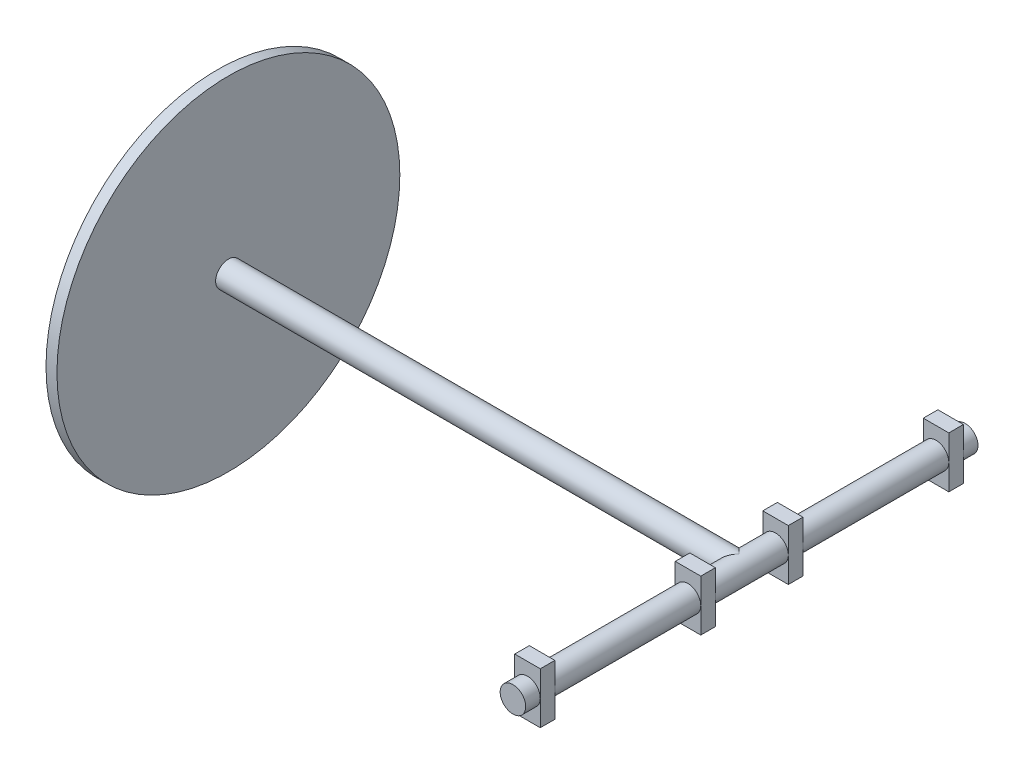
SolidWorks part; units mm, degrees
ref_plane "Face" through (0, 0, 0) normal (0, 0, 1) x (1, 0, 0)
ref_plane "Dessus" through (0, 0, 0) normal (0, 1, 0) x (1, 0, 0)
ref_plane "Droite" through (0, 0, 0) normal (1, 0, 0) x (0, 0, -1)
sketch "Esquisse1" plane through (0, 0, 0) normal (0, 0, 1) x (1, 0, 0)
  circle A0 centre (0, 0) radius 3.5
  dimension "D1" = 7
extrude "Extrusion1" add sketch "Esquisse1" along normal blind 10
sketch "Esquisse2" plane through (0, 0, 10) normal (0, 0, 1) x (1, 0, 0)
  line L1 (-3.5, 7) -> (3.5, 7)
  line L2 (-3.5, 7) -> (-3.5, -7)
  line L3 (-3.5, -7) -> (3.5, -7)
  line L4 (3.5, 7) -> (3.5, -7)
  circle A0 centre (0, 0) radius 3.5 construction
  dimension "D1" = 7
  dimension "D2" = 7
extrude "Extrusion2" add sketch "Esquisse2" along normal blind 4
sketch "Esquisse3" plane through (0, 0, 14) normal (0, 0, 1) x (1, 0, 0)
  arc A0 (-3.5, 0) -> (3.5, 0) centre (0, 0) ccw construction
  arc A1 (-3.5, 0) -> (3.5, 0) centre (0, 0) ccw
  arc A2 (3.5, 0) -> (-3.5, 0) centre (0, 0) ccw construction
  arc A3 (3.5, 0) -> (-3.5, 0) centre (0, 0) ccw
extrude "Extrusion3" add sketch "Esquisse3" along normal blind 40
sketch "Esquisse4" plane through (0, 0, 54) normal (0, 0, 1) x (1, 0, 0)
  line L3 (3.5, 0) -> (3.5, 7)
  line L4 (3.5, 7) -> (-3.5, 7)
  line L5 (-3.5, 7) -> (-3.5, 0)
  line L6 (3.5, 0) -> (3.5, 7)
  line L7 (3.5, 7) -> (-3.5, 7)
  line L8 (-3.5, 7) -> (-3.5, 0)
  line L9 (-3.5, 0) -> (-3.5, -7)
  line L10 (-3.5, -7) -> (3.5, -7)
  line L11 (3.5, -7) -> (3.5, 0)
  line L12 (-3.5, 0) -> (-3.5, -7)
  line L13 (-3.5, -7) -> (3.5, -7)
  line L14 (3.5, -7) -> (3.5, 0)
  arc A1 (3.5, 0) -> (-3.5, 0) centre (0, 0) ccw
  arc A3 (-3.5, 0) -> (3.5, 0) centre (0, 0) ccw
  dimension "D1" = 0
  dimension "D2" = 0
extrude "Extrusion4" add sketch "Esquisse4" along normal blind 4
sketch "Esquisse5" plane through (0, 0, 58) normal (0, 0, 1) x (1, 0, 0)
  arc A0 (-3.5, 0) -> (3.5, 0) centre (0, 0) ccw construction
  arc A1 (-3.5, 0) -> (3.5, 0) centre (0, 0) ccw
  arc A2 (3.5, 0) -> (-3.5, 0) centre (0, 0) ccw construction
  arc A3 (3.5, 0) -> (-3.5, 0) centre (0, 0) ccw
extrude "Extrusion5" add sketch "Esquisse5" along normal blind 4
mirror "Symétrie1" about plane through (0, 0, 0) normal (0, 0, 1) of "Extrusion1", "Extrusion2", "Extrusion3", "Extrusion4", "Extrusion5"
sketch "Esquisse6" plane through (0, 0, 0) normal (1, 0, 0) x (0, 0, -1)
  line L0 (10, 3.5) -> (-10, 3.5) construction
  circle A0 centre (0, 0) radius 3.5
extrude "Extrusion6" add sketch "Esquisse6" against normal blind 140
sketch "Esquisse7" plane through (-140, 0, 0) normal (-1, 0, 0) x (0, 0, 1)
  circle A0 centre (0, 0) radius 47
  dimension "D1" = 94
extrude "Extrusion7" add sketch "Esquisse7" along normal blind 3
